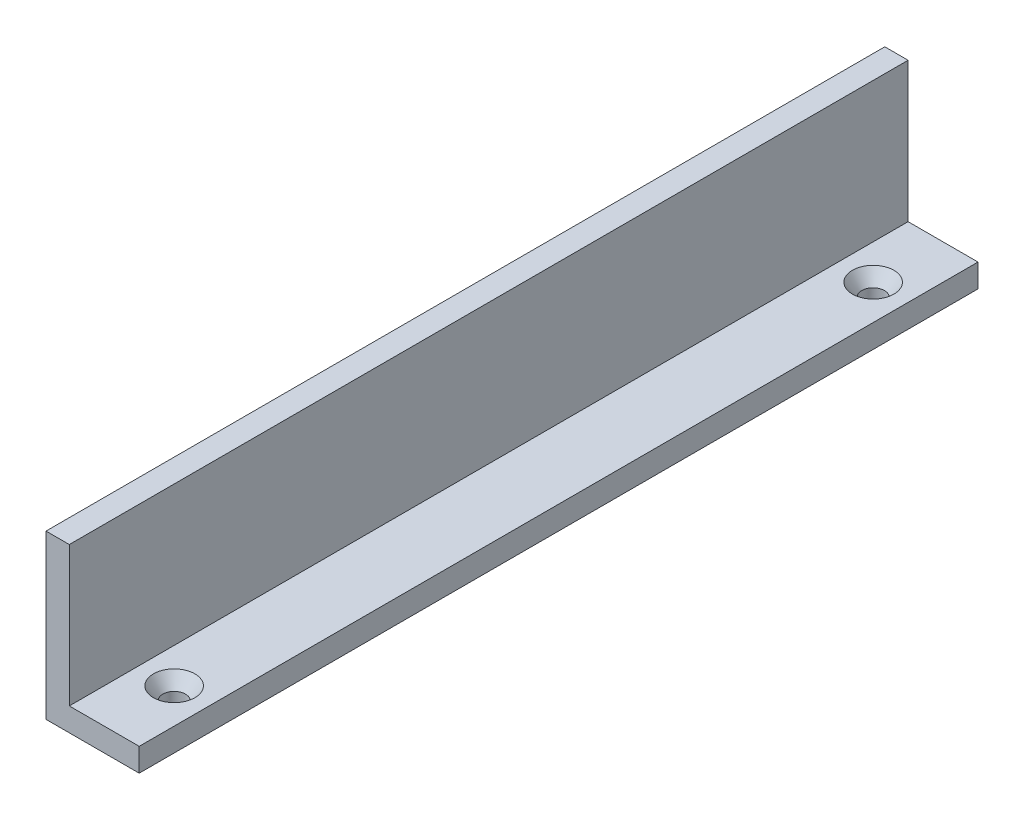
SolidWorks part; units mm, degrees
ref_plane "Front Plane" through (0, 0, 0) normal (0, 0, 1) x (1, 0, 0)
ref_plane "Top Plane" through (0, 0, 0) normal (0, 1, 0) x (1, 0, 0)
ref_plane "Right Plane" through (0, 0, 0) normal (1, 0, 0) x (0, 0, -1)
sketch "Sketch1" plane through (0, 0, 0) normal (0, 0, 1) x (1, 0, 0)
  line L0 (0, 0) -> (0, -22.225)
  line L1 (0, -22.225) -> (12.7, -22.225)
  line L2 (12.7, -22.225) -> (12.7, -19.05)
  line L3 (12.7, -19.05) -> (3.175, -19.05)
  line L4 (3.175, -19.05) -> (3.175, 0)
  line L5 (3.175, 0) -> (0, 0)
  dimension "D1" = 22.225
  dimension "D2" = 12.7
  dimension "D3" = 3.175
  dimension "D4" = 3.175
extrude "Boss-Extrude1" add sketch "Sketch1" along normal blind 114.3
ref_plane "Plane1" through (0, 0, 57.15) normal (0, 0, 1) x (1, 0, 0)
ref_plane "Plane2" through (0, 0, 104.775) normal (0, 0, 1) x (1, 0, 0)
sketch "Sketch2" plane through (0, 0, 104.775) normal (0, 0, 1) x (1, 0, 0)
  line L0 (7.9375, -19.05) -> (7.9375, -30.4759) construction
  line L1 (12.7, -19.05) -> (3.175, -19.05) construction
  line L2 (12.7, -22.225) -> (12.7, -19.05) construction
  line L3 (6.3945, -20.8015) -> (5.1158, -19.05)
  line L4 (7.2549, -19.05) -> (7.9375, -19.05)
  line L5 (6.3945, -24.266) -> (7.9375, -30.3796)
  line L6 (6.3945, -20.8015) -> (6.3945, -24.266)
  line L7 (7.9375, -19.9958) -> (7.9375, -30.3796)
  line L8 (7.2549, -19.05) -> (5.1158, -19.05)
  line L9 (7.9375, -19.9958) -> (7.9375, -19.05) construction
  line L10 (7.9375, -19.05) -> (7.2549, -19.05) construction
  line L11 (7.9375, -19.05) -> (7.9375, -19.9958)
  dimension "D1" = 4.7625
revolve "Cut-Revolve1" cut sketch "Sketch2" angle 360 about L7
mirror "Mirror1" about plane through (0, 0, 57.15) normal (0, 0, 1) of "Cut-Revolve1"
